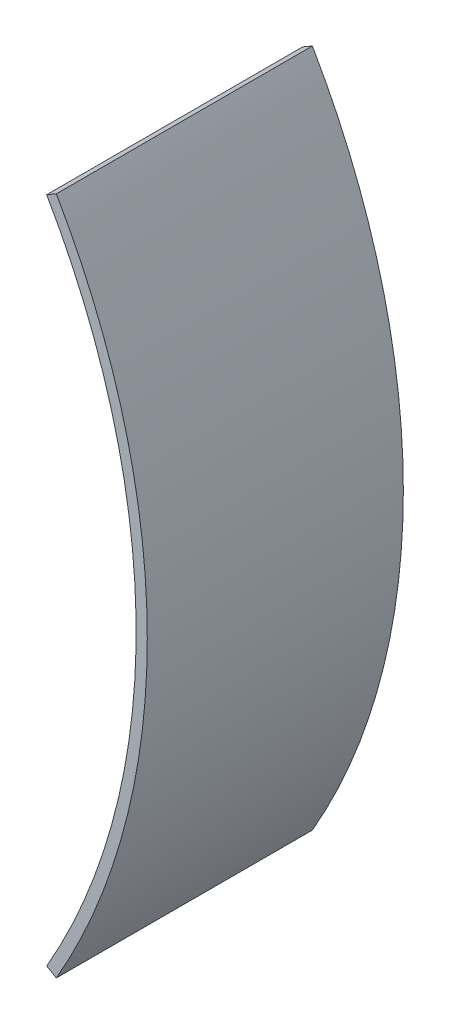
SolidWorks part; units mm, degrees
ref_plane "Plan de face" through (0, 0, 0) normal (0, 0, 1) x (1, 0, 0)
ref_plane "Plan de dessus" through (0, 0, 0) normal (0, 1, 0) x (1, 0, 0)
ref_plane "Plan de droite" through (0, 0, 0) normal (1, 0, 0) x (0, 0, -1)
sketch "Esquisse1" plane through (0, 0, 0) normal (0, 0, 1) x (1, 0, 0)
  line L0 (0, 0) -> (412.4936, 0) construction
  line L1 (72.3602, -60) -> (299.0401, -60)
  line L2 (72.3602, 60) -> (299.0401, 60)
  line L4 (0, 60) -> (412.4936, 60) construction
  line L5 (0, -60) -> (412.4936, -60) construction
  arc A1 (72.3602, -60) -> (72.3602, 60) centre (0, 0) ccw
  circle A2 centre (297.3214, 40) radius 1.5
  circle A3 centre (297.3214, -40) radius 1.5
  arc A5 (297.5177, -38.5129) -> (297.5177, 38.5129) centre (0, 0) ccw construction
  arc A6 (299.0401, -60) -> (299.0401, 60) centre (0, 0) ccw
  dimension "D1" = 188
  dimension "D2" = 300
  dimension "D5" = 3
  dimension "D7" = 610
  dimension "D6" = 80
  dimension "D3" = 60
  dimension "D4" = 60
extrude "Boss.-Extru.1" add sketch "Esquisse1" along normal blind 15
sketch "Esquisse2" plane through (0, 0, 0) normal (0, 0, -1) x (-1, 0, 0)
  line L0 (0, 0) -> (-115.9666, 0) construction
  line L1 (-118, 12) -> (-68.5497, 12)
  line L2 (-118, 12) -> (-118, -12)
  line L3 (-118, -12) -> (-68.5497, -12)
  line L4 (-68.5497, 12) -> (-68.5497, -12)
  arc A0 (-72.3602, 60) -> (-72.3602, -60) centre (0, 0) ccw construction
  point P7 (-94, 0)
  dimension "D1" = 24
  dimension "D2" = 24
extrude "Enlèv. mat.-Extru.1" cut sketch "Esquisse2" against normal blind 12
sketch "Esquisse3" plane through (0, 0, 0) normal (0, 0, -1) x (-1, 0, 0)
  circle A0 centre (0, 0) radius 295
  dimension "D1" = 590
extrude "Enlèv. mat.-Extru.2" cut sketch "Esquisse3" against normal through all contours A0
shell "Coque1" thickness 3
sketch "Esquisse5" plane through (0, 0, 15) normal (0, 0, 1) x (1, 0, 0)
  line L3 (259.8076, 150) -> (264.1377, 152.5)
  line L5 (0, 0) -> (403.0937, 0) construction
  line L6 (259.8076, -150) -> (264.1377, -152.5)
  arc A0 (259.8076, -150) -> (259.8076, 150) centre (0, 0) ccw
  arc A1 (299.0401, -60) -> (299.0401, 60) centre (0, 0) ccw construction
  arc A2 (264.1377, -152.5) -> (264.1377, 152.5) centre (0, 0) ccw
extrude "Boss.-Extru.2" add sketch "Esquisse5" along normal blind 100
sketch "Esquisse6" plane through (0, 0, 15) normal (0, 0, -1) x (-1, 0, 0)
  line L2 (-293.9388, -60) -> (-299.0401, -60)
  line L3 (-264.1377, -152.5) -> (-259.8076, -150)
  line L4 (-293.9388, -60) -> (-299.0401, -60)
  line L5 (-264.1377, -152.5) -> (-259.8076, -150)
  line L6 (-299.0401, 60) -> (-293.9388, 60)
  line L7 (-259.8076, 150) -> (-264.1377, 152.5)
  line L8 (-299.0401, 60) -> (-293.9388, 60)
  line L9 (-259.8076, 150) -> (-264.1377, 152.5)
  arc A2 (-293.9388, -60) -> (-259.8076, -150) centre (0, 0) ccw
  arc A3 (-299.0401, -60) -> (-264.1377, -152.5) centre (0, 0) ccw
  arc A4 (-293.9388, -60) -> (-259.8076, -150) centre (0, 0) ccw
  arc A5 (-299.0401, -60) -> (-264.1377, -152.5) centre (0, 0) ccw
  arc A6 (-264.1377, 152.5) -> (-299.0401, 60) centre (0, 0) ccw
  arc A7 (-259.8076, 150) -> (-293.9388, 60) centre (0, 0) ccw
  arc A8 (-264.1377, 152.5) -> (-299.0401, 60) centre (0, 0) ccw
  arc A9 (-259.8076, 150) -> (-293.9388, 60) centre (0, 0) ccw
  dimension "D1" = 0
  dimension "D2" = 0
extrude "Boss.-Extru.3" add sketch "Esquisse6" along normal up to surface (15 mm away)
fillet "Congé3" radius 5 2 edges at (293.9388, -60, 7.5) (293.9388, 60, 7.5)
